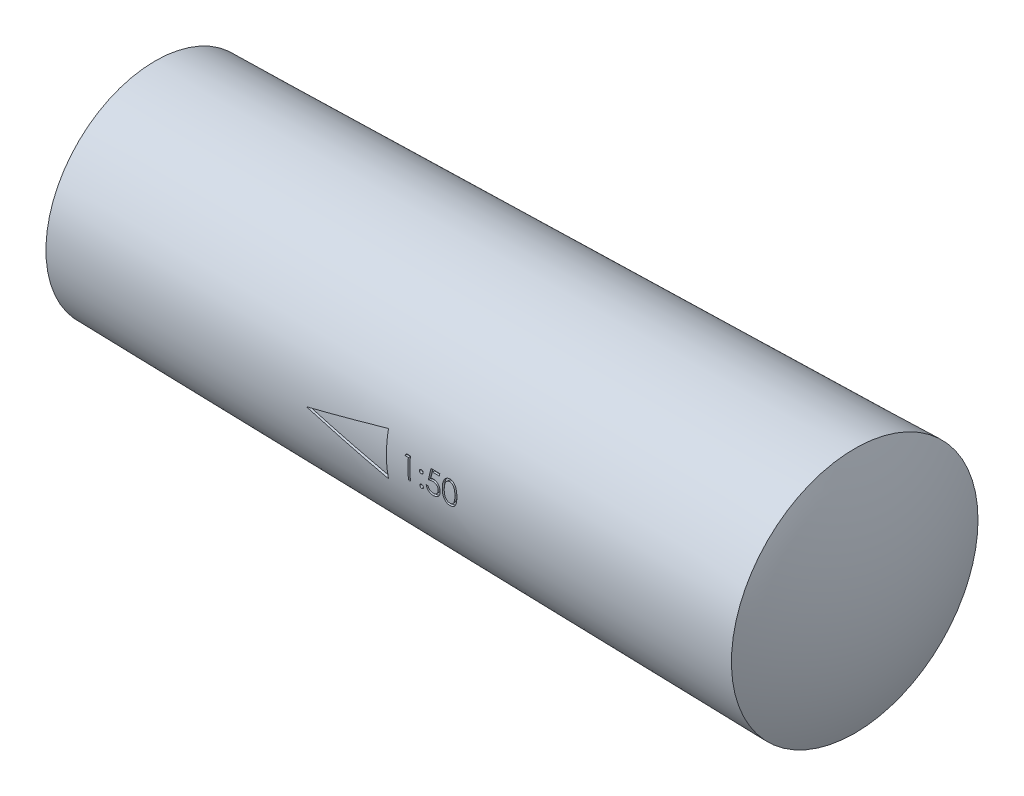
SolidWorks part; units mm, degrees
ref_plane "Front Plane" through (0, 0, 0) normal (0, 0, 1) x (1, 0, 0)
ref_plane "Top Plane" through (0, 0, 0) normal (0, 1, 0) x (1, 0, 0)
ref_plane "Right Plane" through (0, 0, 0) normal (1, 0, 0) x (0, 0, -1)
sketch "Sketch1" plane through (0, 0, 0) normal (1, 0, 0) x (0, 0, -1)
  circle A0 centre (0, 0) radius 5
  dimension "D1" = 10
extrude "Extrude1" add sketch "Sketch1" along normal mid plane 32
draft "Draft1" type of draft neutral plane draft angle 1.146 faces to draft 1 parameters "D1"=1.146
sketch "Sketch2" plane through (0, 0, 0) normal (0, 0, 1) x (1, 0, 0)
  line L0 (-16, 0) -> (-16, 5)
  line L1 (-16, 5) -> (-16, -5) construction
  line L2 (-16, 0) -> (-17.2, 0)
  line L3 (-17.2, 0) -> (-17.2, -5.32) construction
  line L4 (16, 0) -> (16, 5.64)
  line L5 (16, -5.64) -> (16, 5.64) construction
  line L6 (16, 0) -> (17.2, 0)
  line L7 (17.2, 0) -> (17.2, -5.32) construction
  line L8 (-16, -5) -> (16, -5.64) construction
  arc A0 (-17.2, 0) -> (-16, 5) centre (-6.1833, 0) cw
  arc A1 (17.2, 0) -> (16, 5.64) centre (3.3459, 0) ccw
  point P14 (0, -5.32)
revolve "Revolve1" add sketch "Sketch2" angle 360 about L2
sketch "Sketch5" plane through (0, 0, 0) normal (0, 0, 1) x (1, 0, 0)
  line L0 (0, 5.32) -> (0, -5.32) construction
  line L1 (16, 5.64) -> (-16, 5) construction
  line L2 (-16, -5) -> (16, -5.64) construction
ref_plane "Plane2" through (0, 0, 0) normal (-0.02, 0, 0.9998) x (0.9998, 0, 0.02)
sketch "Sketch6" plane through (0, 0, 0) normal (-0.02, 0, 0.9998) x (0.9998, 0, 0.02)
  line L0 (0, 0) -> (0, 1)
  line L1 (0, 5.32) -> (0, -5.32) construction
  line L2 (0, 1) -> (-3.7321, 0)
  line L3 (-3.7321, 0) -> (0, -1)
  line L4 (0, -1) -> (0, 0)
  line L5 (0, -0.5) -> (4, -0.5) construction
  text T0 "1:50" font "Century Gothic" height 1
  dimension "D1" = 2
  dimension "D2" = 30
  dimension "D3" = 4
wrap "Wrap2" sketch "Sketch6" wrap type deboss source sketch "Sketch6" thickness 0.1 parameters "D1"=0.1
equation "\"D2@Sketch2\" = \"D1@Sketch2\""
